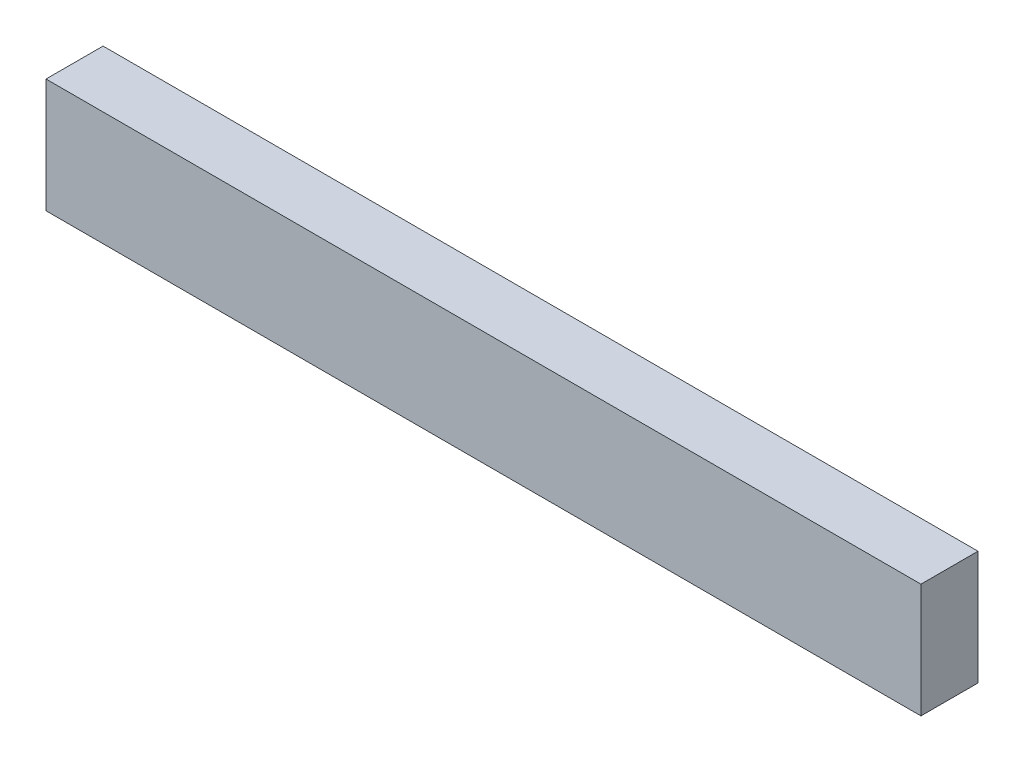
SolidWorks part; units mm, degrees
ref_plane "Plan de face" through (0, 0, 0) normal (0, 0, 1) x (1, 0, 0)
ref_plane "Plan de dessus" through (0, 0, 0) normal (0, 1, 0) x (1, 0, 0)
ref_plane "Plan de droite" through (0, 0, 0) normal (1, 0, 0) x (0, 0, -1)
sketch "Esquisse1" plane through (0, 0, 0) normal (0, 0, 1) x (1, 0, 0)
  line L0 (2.8865, 0) -> (25.8865, 0)
  line L1 (25.8865, 0) -> (25.8865, 3)
  line L2 (2.8865, 0) -> (2.8865, 3)
  line L3 (2.8865, 3) -> (25.8865, 3)
extrude "Boss.-Extru.1" add sketch "Esquisse1" along normal blind 1.5
